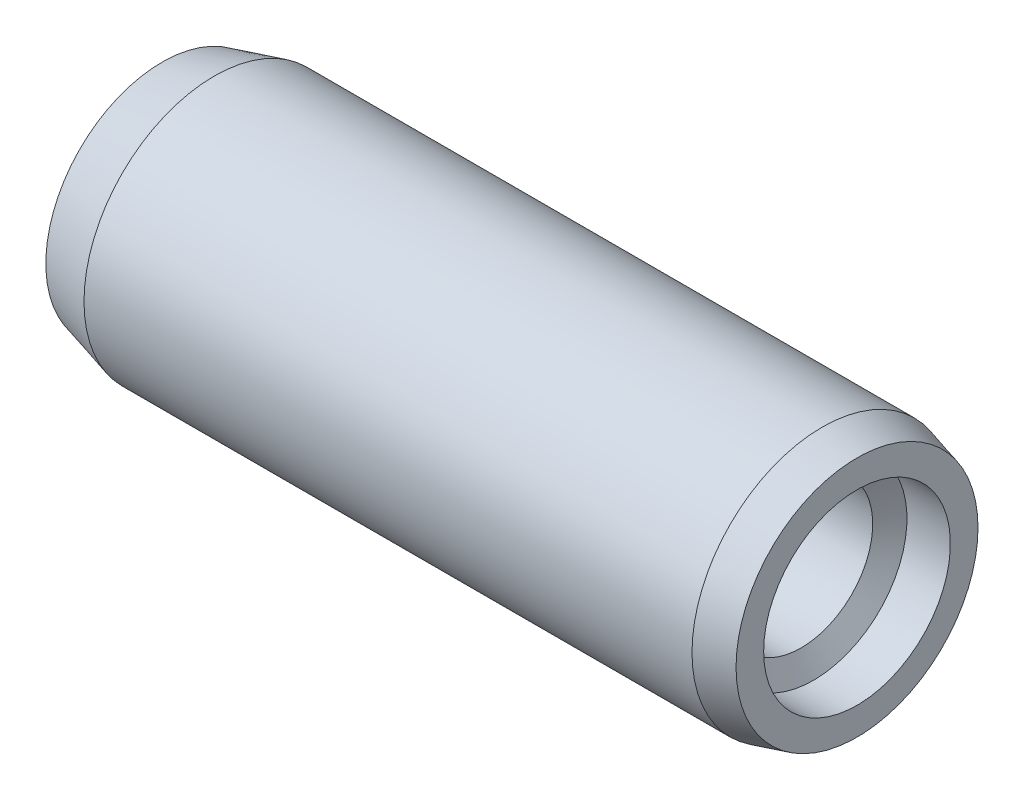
SolidWorks part; units mm, degrees
ref_plane "Front" through (0, 0, 0) normal (0, 0, 1) x (1, 0, 0)
ref_plane "Top" through (0, 0, 0) normal (0, 1, 0) x (1, 0, 0)
ref_plane "Right" through (0, 0, 0) normal (1, 0, 0) x (0, 0, -1)
sketch "Sketch1" plane through (0, 0, 0) normal (0, 0, 1) x (1, 0, 0)
  line L0 (0, 0) -> (0, 2.6785)
  line L1 (0, 2.6785) -> (1.2, 3)
  line L2 (1.2, 3) -> (15.2, 3)
  line L3 (15.2, 3) -> (16, 2.7856)
  line L4 (16, 2.7856) -> (16, 0)
  line L5 (0, 0) -> (-1.8135, 0) construction
  line L6 (16, 0) -> (0, 0)
  dimension "d" = 6
  dimension "c" = 1.2
  dimension "D3" = 15
  dimension "l" = 16
  dimension "a" = 0.8
  dimension "D6" = 75
revolve "Base-Revolve" add sketch "Sketch1" angle 360 about L5
sketch "Sketch2" plane through (0, 0, 0) normal (0, 0, 1) x (1, 0, 0)
  line L0 (16, 2.15) -> (15, 2.15)
  line L2 (16, -2.7856) -> (16, 2.7856) construction
  line L3 (15, 2.15) -> (14.7113, 1.65)
  line L4 (14.7113, 1.65) -> (6, 1.65)
  line L5 (6, 1.65) -> (5.0474, 0)
  line L6 (5.0474, 0) -> (16, 0)
  line L7 (16, 0) -> (16, 2.15)
  line L8 (16, 0) -> (16.5661, 0) construction
  dimension "d2" = 4.3
  dimension "t3" = 1
  dimension "D4" = 60
  dimension "d0" = 3.3
  dimension "D6" = 60
  dimension "t2" = 10
revolve "TypeA" cut sketch "Sketch2" angle 360 about L8
sketch "Sketch3" plane through (0, 0, 0) normal (0, 0, 1) x (1, 0, 0)
  line L0 (0, 0) -> (11.3654, 0) construction
  line L1 (9.835, -1.32) -> (10.165, -1.32)
  line L2 (10.165, -1.32) -> (10.165, -1.65)
  line L3 (10.165, -1.65) -> (10, -1.9358)
  line L4 (10, -1.9358) -> (9.835, -1.65)
  line L5 (9.835, -1.32) -> (9.835, -1.65)
  line L6 (16, -2.15) -> (16, 2.15) construction
  dimension "D1" = 0.33
  dimension "D2" = 3.3
  dimension "D3" = 6
revolve "Cut-Revolve10" [suppressed] cut sketch "Sketch3" angle 360 about L0
pattern_linear "LPattern10" [suppressed] count 13 spacing 0.396 along (1, 0, 0)
equation "\"D1@Sketch3\" =\"D2@Sketch3\" / 10"
equation "\"D2@Sketch3\" = \"d0@Sketch2\""
equation "\"D3@Sketch3\" = \"t1@ThreadCosmetic1\""
equation "\"D3@LPattern10\" = \"D1@Sketch3\"*1.2"
equation "\"D1@LPattern10\" = (  \"t1@ThreadCosmetic1\"  - \"a@Sketch1\" ) / \"D3@LPattern10\""
